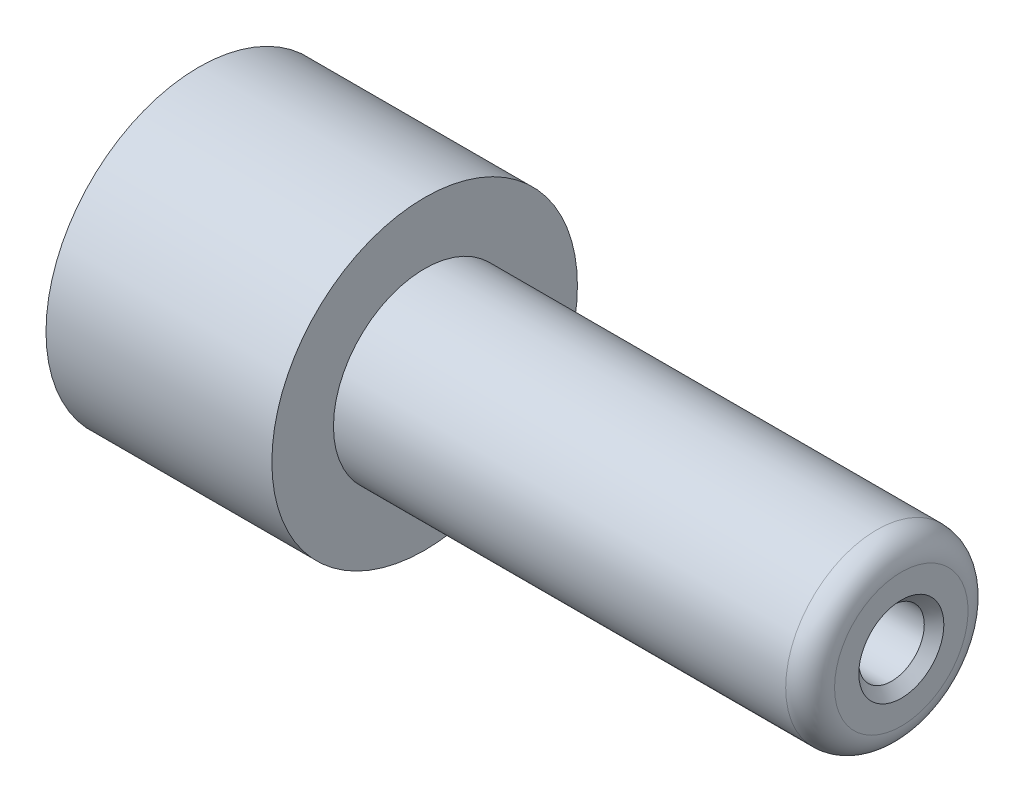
SolidWorks part; units mm, degrees
ref_plane "Front Plane" through (0, 0, 0) normal (0, 0, 1) x (1, 0, 0)
ref_plane "Top Plane" through (0, 0, 0) normal (0, 1, 0) x (1, 0, 0)
ref_plane "Right Plane" through (0, 0, 0) normal (1, 0, 0) x (0, 0, -1)
sketch "Sketch1" plane through (0, 0, 0) normal (0, 0, 1) x (1, 0, 0)
  line L0 (0, 0) -> (102.3864, 0) construction
  line L1 (0, 3.5687) -> (0, 7.9375)
  line L2 (0, 7.9375) -> (11.7348, 7.9375)
  line L3 (11.7348, 7.9375) -> (11.7348, 4.7371)
  line L4 (11.7348, 4.7371) -> (35.2298, 4.7371)
  line L5 (36.4998, 3.4671) -> (36.4998, 0)
  line L6 (36.4998, 0) -> (24.4856, 0)
  line L7 (0, 3.5687) -> (24.4856, 3.5687)
  line L8 (24.4856, 3.5687) -> (24.4856, 0)
  arc A0 (36.4998, 3.4671) -> (35.2298, 4.7371) centre (35.2298, 3.4671) ccw
  dimension "D5" = 1.27
  dimension "D1" = 11.7348
  dimension "D2" = 15.875
  dimension "D3" = 24.4856
  dimension "D4" = 7.1374
  dimension "D6" = 36.4998
  dimension "D7" = 9.4742
revolve "Revolve1" add sketch "Sketch1" angle 360 about L0
sketch "Sketch2" plane through (0, 0, 0) normal (-1, 0, 0) x (0, 0, 1)
  line L0 (0, 0) -> (9.7644, 0) construction
  circle A0 centre (0, 5.5499) radius 1.1811
  circle A1 centre (0, -5.5499) radius 1.1811
  dimension "D2" = 2.3622
  dimension "D1" = 11.0998
extrude "Cut-Extrude1" cut sketch "Sketch2" against normal blind 2.3876
sketch "Sketch3" plane through (36.4998, 0, 0) normal (1, 0, 0) x (0, 0, -1)
  circle A0 centre (0, 0) radius 1.7018
  dimension "D1" = 3.4036
extrude "Cut-Extrude2" cut sketch "Sketch3" against normal blind 9.525
chamfer "Chamfer1" distance 0.508 angle 45 1 edges at (36.4998, 0, -1.7018)
